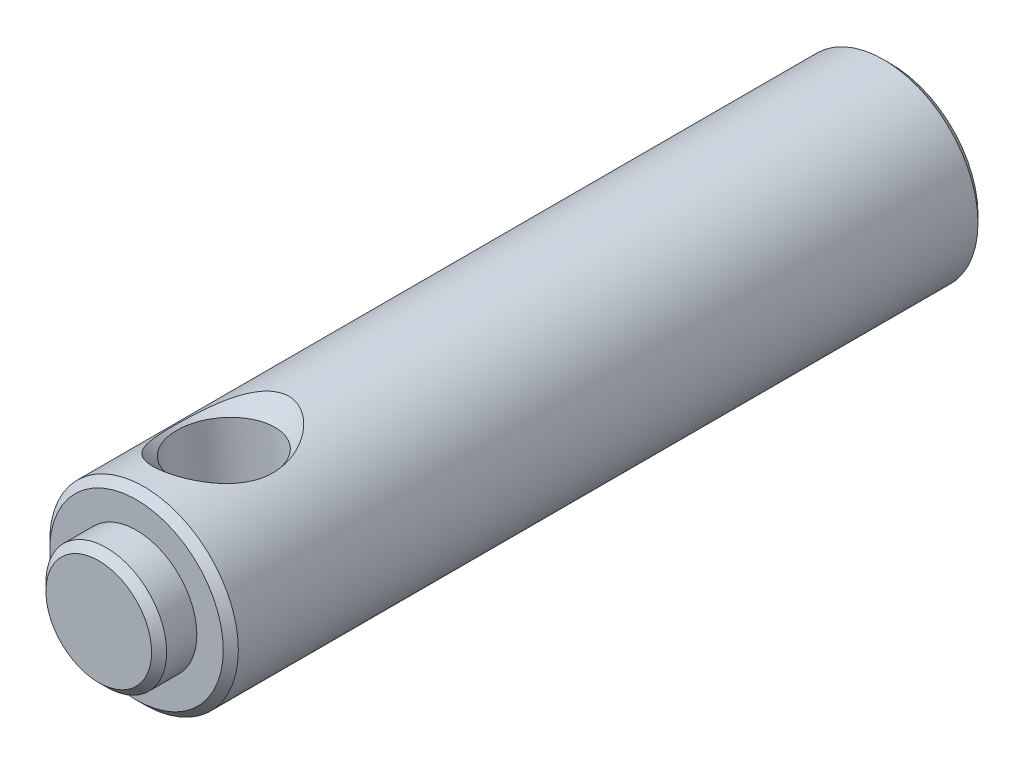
SolidWorks part; units mm, degrees
ref_plane "Ebene vorne" through (0, 0, 0) normal (0, 0, 1) x (1, 0, 0)
ref_plane "Ebene oben" through (0, 0, 0) normal (0, 1, 0) x (1, 0, 0)
ref_plane "Ebene rechts" through (0, 0, 0) normal (1, 0, 0) x (0, 0, -1)
sketch "Skizze1" plane through (0, 0, 0) normal (0, 0, 1) x (1, 0, 0)
  circle A0 centre (0, 0) radius 2.5
  dimension "D1" = 5
extrude "Aufsatz-Linear austragen1" add sketch "Skizze1" along normal blind 20
sketch "Skizze2" plane through (0, 0, 20) normal (0, 0, 1) x (1, 0, 0)
  circle A0 centre (0, 0) radius 1.6
  dimension "D1" = 3.2
extrude "Dorn für Feder" add sketch "Skizze2" along normal blind 1
hole_wizard "M3 Gewindebohrung1" positions "3D-Skizze1" profile "Skizze3" tap size "M3" standard "DIN"
sketch3d "3D-Skizze1"
  point P2 (-0.2257, 2.4898, 17.5)
  dimension "D1" = 2.5
sketch "Skizze3" plane through (-0.2257, 2.4898, 17.5) normal (0, 0, 1) x (-0.9959, -0.0903, 0)
  line L0 (0, 0) -> (0, 5)
  line L1 (0, 5) -> (1.7, 5)
  line L2 (1.25, 4.55) -> (1.25, 0.45)
  line L3 (1.25, 0.45) -> (1.7, 0)
  line L5 (1.7, 0) -> (0, 0)
  line L6 (-1.25, 0.45) -> (-1.7, 0) construction
  line L7 (1.7, 5) -> (1.25, 4.55)
  line L8 (-1.7, 5) -> (-1.25, 4.55) construction
  line L11 (0, -6.35) -> (0, 107.95) construction
  dimension "Bohrerdurchmesser" = 2.5
  dimension "Bohrungstiefe" = 5
  dimension "Senkdurchmesser (Oben)" = 3.4
  dimension "Senkwinkel (Oben)" = 90
  dimension "Senkdurchmesser (Unten)" = 3.4
  dimension "Senkwinkel (Unten)" = 90
chamfer "Fase1" distance 0.2 angle 45 3 edges at (1.6, 0, 21) (2.5, 0, 20) (2.5, 0, 0)
